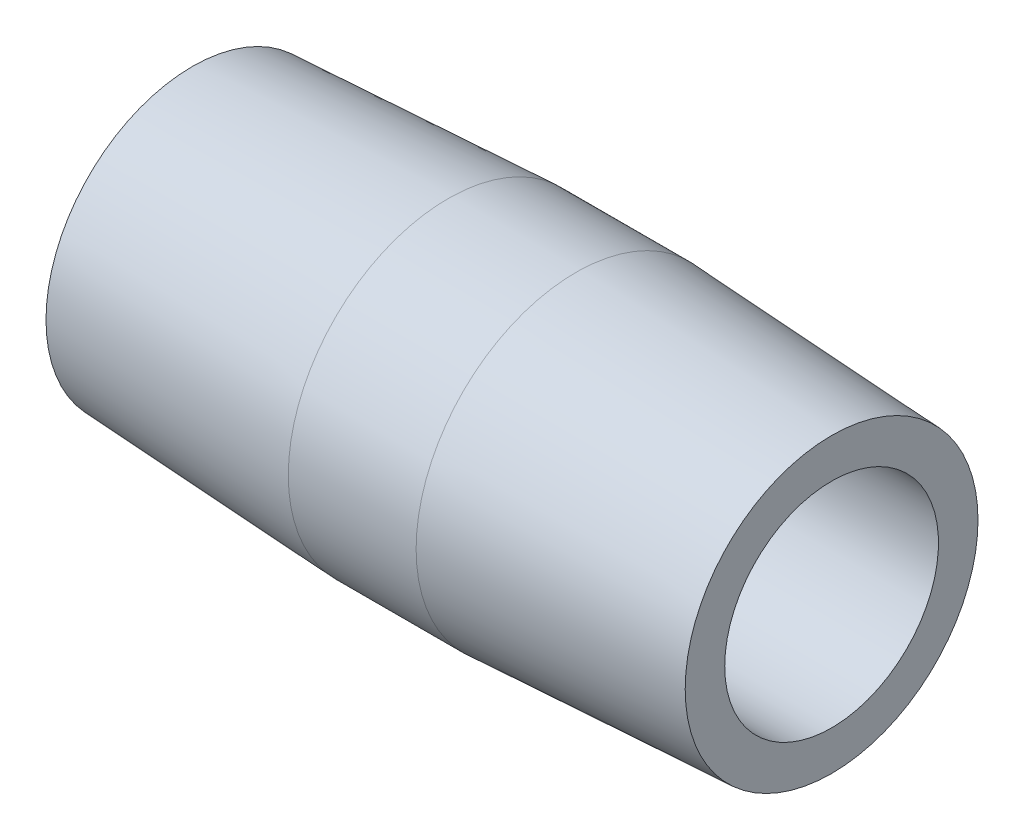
SolidWorks part; units mm, degrees
ref_plane "Front Plane" through (0, 0, 0) normal (0, 0, 1) x (1, 0, 0)
ref_plane "Top Plane" through (0, 0, 0) normal (0, 1, 0) x (1, 0, 0)
ref_plane "Right Plane" through (0, 0, 0) normal (1, 0, 0) x (0, 0, -1)
sketch "Sketch2" plane through (0, 0, 0) normal (0, 0, 1) x (1, 0, 0)
  line L0 (0.4761, 0) -> (50000.4761, 0) construction
  line L1 (0, -11.3625) -> (0, 49988.6375) construction
  line L7 (6.35, 3.9688) -> (0, 3.636)
  line L8 (9.525, 3.9688) -> (6.35, 3.9688)
  line L9 (15.875, 3.636) -> (9.525, 3.9688)
  line L10 (15.875, 2.6543) -> (15.875, 3.636)
  line L11 (15.875, 2.6543) -> (0, 2.6543)
  line L12 (0, 3.636) -> (0, 2.6543)
  dimension "D1" = 5.3086
  dimension "D2" = 7.9375
  dimension "D3" = 3
  dimension "D4" = 3
  dimension "D5" = 6.35
  dimension "D6" = 6.35
  dimension "D7" = 15.875
revolve "Revolve1" add sketch "Sketch2" angle 360 about L0
